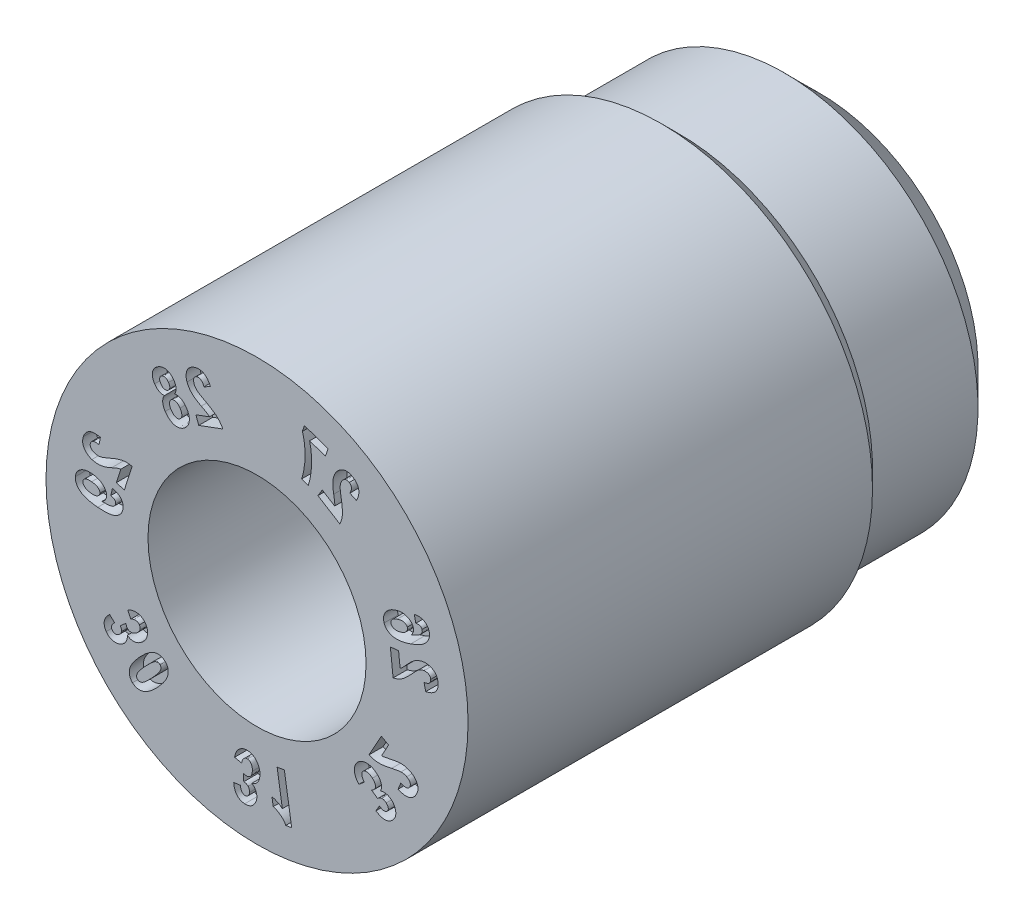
SolidWorks part; units mm, degrees
ref_plane "Front Plane" through (0, 0, 0) normal (0, 0, 1) x (1, 0, 0)
ref_plane "Top Plane" through (0, 0, 0) normal (0, 1, 0) x (1, 0, 0)
ref_plane "Right Plane" through (0, 0, 0) normal (1, 0, 0) x (0, 0, -1)
sketch "Sketch2" plane through (0, 0, 0) normal (0, 1, 0) x (1, 0, 0)
  line L0 (0, 4.8491) -> (0, -49995.1509) construction
  line L10 (2.2496, 8) -> (0.8, 8)
  line L11 (2.75, 7.4996) -> (2.2496, 8)
  line L12 (2.75, 6) -> (2.75, 7.4996)
  line L13 (3, 5.75) -> (2.75, 6)
  line L14 (3, 0) -> (3, 5.75)
  line L15 (1.55, 0) -> (3, 0)
  line L16 (1.55, 0) -> (1.55, 5.5)
  line L17 (0.8, 5.5) -> (1.55, 5.5)
  line L18 (0.8, 5.5) -> (0.8, 8)
  dimension "D1" = 6
  dimension "D2" = 3.1
  dimension "D3" = 2.5
  dimension "D4" = 1.6
  dimension "D5" = 5.5
  dimension "D6" = 8
  dimension "D7" = 45
  dimension "D8" = 45
  dimension "D9" = 2
  dimension "D10" = 0.5004
revolve "Revolve1" add sketch "Sketch2" angle 360 about L0
sketch "Sketch8" plane through (0, 0, 0) normal (0, 0, 1) x (1, 0, 0)
  line L0 (0, 0) -> (2.3455, 1.8705) construction
  line L1 (0, 0) -> (2.9248, -0.6676) construction
  line L2 (0, 0) -> (1.3017, -2.7029) construction
  line L3 (0, 0) -> (-1.3017, -2.7029) construction
  line L4 (0, 0) -> (-2.9248, -0.6676) construction
  line L5 (0, 0) -> (-2.3455, 1.8705) construction
  line L97 (0, 0) -> (0, 3) construction
  circle A30 centre (0, 0) radius 1.9367 construction
  circle A31 centre (0, 0) radius 3 construction
  text T0 "26    27    28    29    30    31    32" font "Arial Narrow" height 0.66
  point P10 (0, 0)
  dimension "D1" = 7
extrude "Cut-Extrude2" cut sketch "Sketch8" against normal blind 0.2
